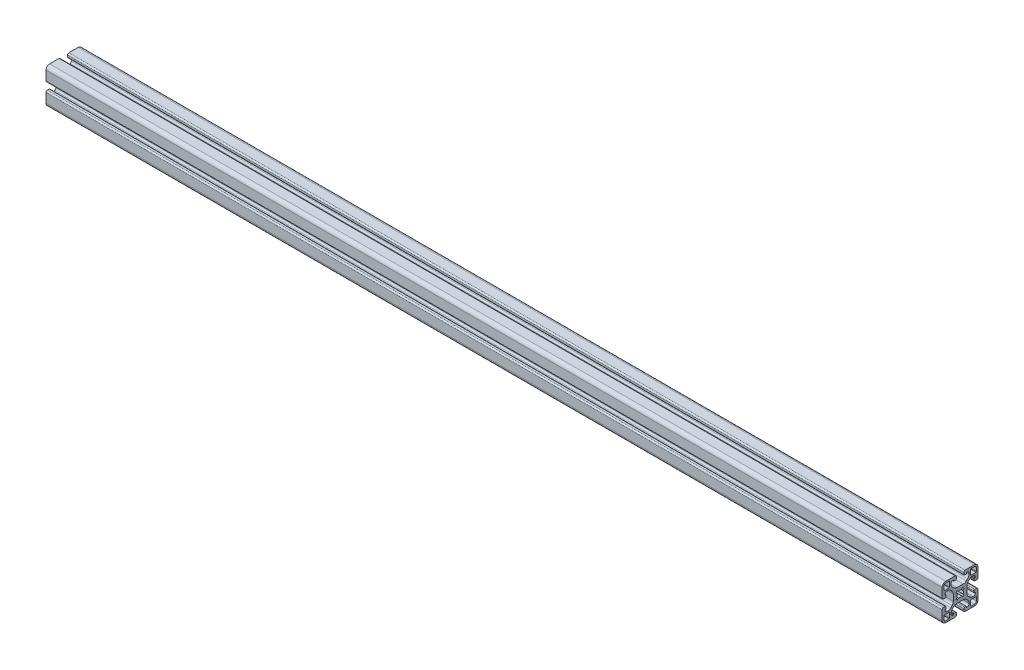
SolidWorks part; units mm, degrees
ref_plane "Front Plane" through (0, 0, 0) normal (0, 0, 1) x (1, 0, 0)
ref_plane "Top Plane" through (0, 0, 0) normal (0, 1, 0) x (1, 0, 0)
ref_plane "Right Plane" through (0, 0, 0) normal (1, 0, 0) x (0, 0, -1)
sketch3d "3DSketch1"
  line L0 (0, 0, 0) -> (1000, 0, 0)
  dimension "D1" = 1000
other "40-sarja 1.0112 40X40 6M(2)"
ref_plane "Plane1" through (0, 0, 0) normal (1, 0, 0) x (0, 0, -1)
sketch "Model4" plane through (0, 0, 0) normal (1, 0, 0) x (0, 0, -1)
  line L0 (-10.3161, -8.3769) -> (-8.9495, -6.9167)
  line L1 (11.8, -17.7) -> (11.8, -12.3)
  line L2 (-18.2, -16) -> (-18.2, -12.3)
  line L3 (17.7, 11.8) -> (12.3, 11.8)
  line L4 (1.7935, 3.2077) -> (2.8287, 4.2429)
  line L5 (-11.8, 17.7) -> (-11.8, 12.3)
  line L6 (12.3, -11.8) -> (17.7, -11.8)
  line L7 (18.2, -12.3) -> (18.2, -16)
  line L8 (16, -18.2) -> (12.3, -18.2)
  line L9 (-17.7, -11.8) -> (-12.3, -11.8)
  line L10 (-11.8, -12.3) -> (-11.8, -17.7)
  line L11 (-12.3, -18.2) -> (-16, -18.2)
  line L12 (11.8, 12.3) -> (11.8, 17.7)
  line L13 (12.3, 18.2) -> (16, 18.2)
  line L14 (18.2, 16) -> (18.2, 12.3)
  line L15 (3.3944, 4.3843) -> (4.2429, 3.5358)
  line L16 (4.3843, 2.9701) -> (3.2077, 1.7935)
  line L17 (3.2077, -1.7935) -> (4.2429, -2.8287)
  line L18 (4.3843, -3.3944) -> (3.3944, -4.3843)
  line L19 (2.8287, -4.2429) -> (1.7935, -3.2077)
  line L20 (-1.7935, -3.2077) -> (-2.8287, -4.2429)
  line L21 (-3.3944, -4.3843) -> (-4.2429, -3.5358)
  line L22 (-4.3843, -2.9701) -> (-3.2077, -1.7935)
  line L23 (-3.2077, 1.7935) -> (-4.2429, 2.8287)
  line L24 (-4.3843, 3.3944) -> (-3.3944, 4.3843)
  line L25 (-2.8287, 4.2429) -> (-1.7935, 3.2077)
  line L26 (-12.3, 11.8) -> (-17.7, 11.8)
  line L27 (-18.2, 12.3) -> (-18.2, 16)
  line L28 (-16, 18.2) -> (-12.3, 18.2)
  line L29 (-14.8, -10) -> (-14.0584, -10)
  line L30 (-17, -7.6) -> (-17, -7.8)
  line L31 (-16, -7.1) -> (-16.5, -7.1)
  line L32 (-15.5, -5.1) -> (-15.5, -6.6)
  line L33 (-18.5, -4.1) -> (-16.5, -4.1)
  line L34 (-20, -16) -> (-20, -5.6)
  line L35 (-5.6, -20) -> (-16, -20)
  line L36 (-4.1, -16.5) -> (-4.1, -18.5)
  line L37 (-6.6, -15.5) -> (-5.1, -15.5)
  line L38 (-7.1, -16.5) -> (-7.1, -16)
  line L39 (-7.8, -17) -> (-7.6, -17)
  line L40 (-10, -14.0533) -> (-10, -14.8)
  line L41 (-6.9127, -8.9458) -> (-8.3744, -10.3108)
  line L42 (3.5, -7.6) -> (-3.5, -7.6)
  line L43 (8.3744, -10.3108) -> (6.9127, -8.9458)
  line L44 (10, -14.8) -> (10, -14.0533)
  line L45 (7.6, -17) -> (7.8, -17)
  line L46 (7.1, -16) -> (7.1, -16.5)
  line L47 (5.1, -15.5) -> (6.6, -15.5)
  line L48 (4.1, -18.5) -> (4.1, -16.5)
  line L49 (16, -20) -> (5.6, -20)
  line L50 (20, -5.6) -> (20, -16)
  line L51 (16.5, -4.1) -> (18.5, -4.1)
  line L52 (15.5, -6.6) -> (15.5, -5.1)
  line L53 (16.5, -7.1) -> (16, -7.1)
  line L54 (17, -7.8) -> (17, -7.6)
  line L55 (14.0584, -10) -> (14.8, -10)
  line L56 (8.9495, -6.9167) -> (10.3161, -8.3769)
  line L57 (7.6, 3.5) -> (7.6, -3.5)
  line L58 (10.3161, 8.3769) -> (8.9495, 6.9167)
  line L59 (14.8, 10) -> (14.0584, 10)
  line L60 (17, 7.6) -> (17, 7.8)
  line L61 (16, 7.1) -> (16.5, 7.1)
  line L62 (15.5, 5.1) -> (15.5, 6.6)
  line L63 (18.5, 4.1) -> (16.5, 4.1)
  line L64 (20, 16) -> (20, 5.6)
  line L65 (5.6, 20) -> (16, 20)
  line L66 (4.1, 16.5) -> (4.1, 18.5)
  line L67 (6.6, 15.5) -> (5.1, 15.5)
  line L68 (7.1, 16.5) -> (7.1, 16)
  line L69 (7.8, 17) -> (7.6, 17)
  line L70 (10, 14.0533) -> (10, 14.8)
  line L71 (6.9127, 8.9458) -> (8.3744, 10.3108)
  line L72 (-3.5, 7.6) -> (3.5, 7.6)
  line L73 (-8.3744, 10.3108) -> (-6.9127, 8.9458)
  line L74 (-10, 14.8) -> (-10, 14.0533)
  line L75 (-7.6, 17) -> (-7.8, 17)
  line L76 (-7.1, 16) -> (-7.1, 16.5)
  line L77 (-5.1, 15.5) -> (-6.6, 15.5)
  line L78 (-4.1, 18.5) -> (-4.1, 16.5)
  line L79 (-16, 20) -> (-5.6, 20)
  line L80 (-20, 5.6) -> (-20, 16)
  line L81 (-16.5, 4.1) -> (-18.5, 4.1)
  line L82 (-15.5, 6.6) -> (-15.5, 5.1)
  line L83 (-16.5, 7.1) -> (-16, 7.1)
  line L84 (-17, 7.8) -> (-17, 7.6)
  line L85 (-14.0584, 10) -> (-14.8, 10)
  line L86 (-8.9495, 6.9167) -> (-10.3161, 8.3769)
  line L87 (-7.6, -3.5) -> (-7.6, 3.5)
  line L88 (2.8287, -4.2429) -> (2.9701, -4.3843)
  line L89 (4.2429, -2.8287) -> (4.3843, -2.9701)
  line L90 (-2.8287, -4.2429) -> (-2.9701, -4.3843)
  line L91 (-4.2429, -3.5358) -> (-4.3843, -3.3944)
  line L92 (-4.2429, 2.8287) -> (-4.3843, 2.9701)
  line L93 (-2.8287, 4.2429) -> (-2.9701, 4.3843)
  line L94 (2.8287, 4.2429) -> (2.9701, 4.3843)
  line L95 (4.2429, 3.5358) -> (4.3843, 3.3944)
  arc A0 (12.3, -11.8) -> (11.8, -12.3) centre (12.3, -12.3) ccw
  arc A1 (18.2, -12.3) -> (17.7, -11.8) centre (17.7, -12.3) ccw
  arc A2 (16, -18.2) -> (18.2, -16) centre (16, -16) ccw
  arc A3 (11.8, -17.7) -> (12.3, -18.2) centre (12.3, -17.7) ccw
  arc A4 (-17.7, -11.8) -> (-18.2, -12.3) centre (-17.7, -12.3) ccw
  arc A5 (-11.8, -12.3) -> (-12.3, -11.8) centre (-12.3, -12.3) ccw
  arc A6 (-12.3, -18.2) -> (-11.8, -17.7) centre (-12.3, -17.7) ccw
  arc A7 (-18.2, -16) -> (-16, -18.2) centre (-16, -16) ccw
  arc A8 (11.8, 12.3) -> (12.3, 11.8) centre (12.3, 12.3) ccw
  arc A9 (12.3, 18.2) -> (11.8, 17.7) centre (12.3, 17.7) ccw
  arc A10 (18.2, 16) -> (16, 18.2) centre (16, 16) ccw
  arc A11 (17.7, 11.8) -> (18.2, 12.3) centre (17.7, 12.3) ccw
  arc A23 (1.7935, 3.2077) -> (-1.7935, 3.2077) centre (0, 0) ccw
  arc A24 (-12.3, 11.8) -> (-11.8, 12.3) centre (-12.3, 12.3) ccw
  arc A25 (-18.2, 12.3) -> (-17.7, 11.8) centre (-17.7, 12.3) ccw
  arc A26 (-16, 18.2) -> (-18.2, 16) centre (-16, 16) ccw
  arc A27 (-11.8, 17.7) -> (-12.3, 18.2) centre (-12.3, 17.7) ccw
  arc A28 (-14.0584, -10) -> (-10.3161, -8.3769) centre (-14.0584, -4.8744) ccw
  arc A29 (-17, -7.8) -> (-14.8, -10) centre (-14.8, -7.8) ccw
  arc A30 (-16.5, -7.1) -> (-17, -7.6) centre (-16.5, -7.6) ccw
  arc A31 (-16, -7.1) -> (-15.5, -6.6) centre (-16, -6.6) ccw
  arc A32 (-15.5, -5.1) -> (-16.5, -4.1) centre (-16.5, -5.1) ccw
  arc A33 (-18.5, -4.1) -> (-20, -5.6) centre (-18.5, -5.6) ccw
  arc A34 (-20, -16) -> (-16, -20) centre (-16, -16) ccw
  arc A35 (-5.6, -20) -> (-4.1, -18.5) centre (-5.6, -18.5) ccw
  arc A36 (-4.1, -16.5) -> (-5.1, -15.5) centre (-5.1, -16.5) ccw
  arc A37 (-6.6, -15.5) -> (-7.1, -16) centre (-6.6, -16) ccw
  arc A38 (-7.6, -17) -> (-7.1, -16.5) centre (-7.6, -16.5) ccw
  arc A39 (-10, -14.8) -> (-7.8, -17) centre (-7.8, -14.8) ccw
  arc A40 (-8.3744, -10.3108) -> (-10, -14.0533) centre (-4.8793, -14.0533) ccw
  arc A41 (-3.5, -7.6) -> (-6.9127, -8.9458) centre (-3.5, -12.6) ccw
  arc A42 (6.9127, -8.9458) -> (3.5, -7.6) centre (3.5, -12.6) ccw
  arc A43 (10, -14.0533) -> (8.3744, -10.3108) centre (4.8793, -14.0533) ccw
  arc A44 (7.8, -17) -> (10, -14.8) centre (7.8, -14.8) ccw
  arc A45 (7.1, -16.5) -> (7.6, -17) centre (7.6, -16.5) ccw
  arc A46 (7.1, -16) -> (6.6, -15.5) centre (6.6, -16) ccw
  arc A47 (5.1, -15.5) -> (4.1, -16.5) centre (5.1, -16.5) ccw
  arc A48 (4.1, -18.5) -> (5.6, -20) centre (5.6, -18.5) ccw
  arc A49 (16, -20) -> (20, -16) centre (16, -16) ccw
  arc A50 (20, -5.6) -> (18.5, -4.1) centre (18.5, -5.6) ccw
  arc A51 (16.5, -4.1) -> (15.5, -5.1) centre (16.5, -5.1) ccw
  arc A52 (15.5, -6.6) -> (16, -7.1) centre (16, -6.6) ccw
  arc A53 (17, -7.6) -> (16.5, -7.1) centre (16.5, -7.6) ccw
  arc A54 (14.8, -10) -> (17, -7.8) centre (14.8, -7.8) ccw
  arc A55 (10.3161, -8.3769) -> (14.0584, -10) centre (14.0584, -4.8744) ccw
  arc A56 (7.6, -3.5) -> (8.9495, -6.9167) centre (12.6, -3.5) ccw
  arc A57 (8.9495, 6.9167) -> (7.6, 3.5) centre (12.6, 3.5) ccw
  arc A58 (14.0584, 10) -> (10.3161, 8.3769) centre (14.0584, 4.8744) ccw
  arc A59 (17, 7.8) -> (14.8, 10) centre (14.8, 7.8) ccw
  arc A60 (16.5, 7.1) -> (17, 7.6) centre (16.5, 7.6) ccw
  arc A61 (16, 7.1) -> (15.5, 6.6) centre (16, 6.6) ccw
  arc A62 (15.5, 5.1) -> (16.5, 4.1) centre (16.5, 5.1) ccw
  arc A63 (18.5, 4.1) -> (20, 5.6) centre (18.5, 5.6) ccw
  arc A64 (20, 16) -> (16, 20) centre (16, 16) ccw
  arc A65 (5.6, 20) -> (4.1, 18.5) centre (5.6, 18.5) ccw
  arc A66 (4.1, 16.5) -> (5.1, 15.5) centre (5.1, 16.5) ccw
  arc A67 (6.6, 15.5) -> (7.1, 16) centre (6.6, 16) ccw
  arc A68 (7.6, 17) -> (7.1, 16.5) centre (7.6, 16.5) ccw
  arc A69 (10, 14.8) -> (7.8, 17) centre (7.8, 14.8) ccw
  arc A70 (8.3744, 10.3108) -> (10, 14.0533) centre (4.8793, 14.0533) ccw
  arc A71 (3.5, 7.6) -> (6.9127, 8.9458) centre (3.5, 12.6) ccw
  arc A72 (-6.9127, 8.9458) -> (-3.5, 7.6) centre (-3.5, 12.6) ccw
  arc A73 (-10, 14.0533) -> (-8.3744, 10.3108) centre (-4.8793, 14.0533) ccw
  arc A74 (-7.8, 17) -> (-10, 14.8) centre (-7.8, 14.8) ccw
  arc A75 (-7.1, 16.5) -> (-7.6, 17) centre (-7.6, 16.5) ccw
  arc A76 (-7.1, 16) -> (-6.6, 15.5) centre (-6.6, 16) ccw
  arc A77 (-5.1, 15.5) -> (-4.1, 16.5) centre (-5.1, 16.5) ccw
  arc A78 (-4.1, 18.5) -> (-5.6, 20) centre (-5.6, 18.5) ccw
  arc A79 (-16, 20) -> (-20, 16) centre (-16, 16) ccw
  arc A80 (-20, 5.6) -> (-18.5, 4.1) centre (-18.5, 5.6) ccw
  arc A81 (-16.5, 4.1) -> (-15.5, 5.1) centre (-16.5, 5.1) ccw
  arc A82 (-15.5, 6.6) -> (-16, 7.1) centre (-16, 6.6) ccw
  arc A83 (-17, 7.6) -> (-16.5, 7.1) centre (-16.5, 7.6) ccw
  arc A84 (-14.8, 10) -> (-17, 7.8) centre (-14.8, 7.8) ccw
  arc A85 (-10.3161, 8.3769) -> (-14.0584, 10) centre (-14.0584, 4.8744) ccw
  arc A86 (-7.6, 3.5) -> (-8.9495, 6.9167) centre (-12.6, 3.5) ccw
  arc A87 (-8.9495, -6.9167) -> (-7.6, -3.5) centre (-12.6, -3.5) ccw
  arc A88 (-3.2077, 1.7935) -> (-3.2077, -1.7935) centre (0, 0) ccw
  arc A89 (3.2077, -1.7935) -> (3.2077, 1.7935) centre (0, 0) ccw
  arc A90 (-1.7935, -3.2077) -> (1.7935, -3.2077) centre (0, 0) ccw
  arc A91 (2.9701, 4.3843) -> (3.3944, 4.3843) centre (3.1822, 4.1722) cw
  arc A92 (4.3843, 3.3944) -> (4.3843, 2.9701) centre (4.1722, 3.1822) cw
  arc A93 (4.3843, -2.9701) -> (4.3843, -3.3944) centre (4.1722, -3.1822) cw
  arc A94 (3.3944, -4.3843) -> (2.9701, -4.3843) centre (3.1822, -4.1722) cw
  arc A95 (-2.9701, -4.3843) -> (-3.3944, -4.3843) centre (-3.1822, -4.1722) cw
  arc A96 (-4.3843, -3.3944) -> (-4.3843, -2.9701) centre (-4.1722, -3.1822) cw
  arc A97 (-4.3843, 3.3944) -> (-4.3843, 2.9701) centre (-4.1722, 3.1822) ccw
  arc A98 (-2.9701, 4.3843) -> (-3.3944, 4.3843) centre (-3.1822, 4.1722) ccw
  point P257 (-20, 20)
  point P258 (20, 20)
  point P259 (-20, -20)
  point P260 (20, -20)
  point P261 (0, -20)
  point P262 (20, 0)
  point P263 (-20, 0)
  point P264 (0, 20)
  point P273 (0, 0)
